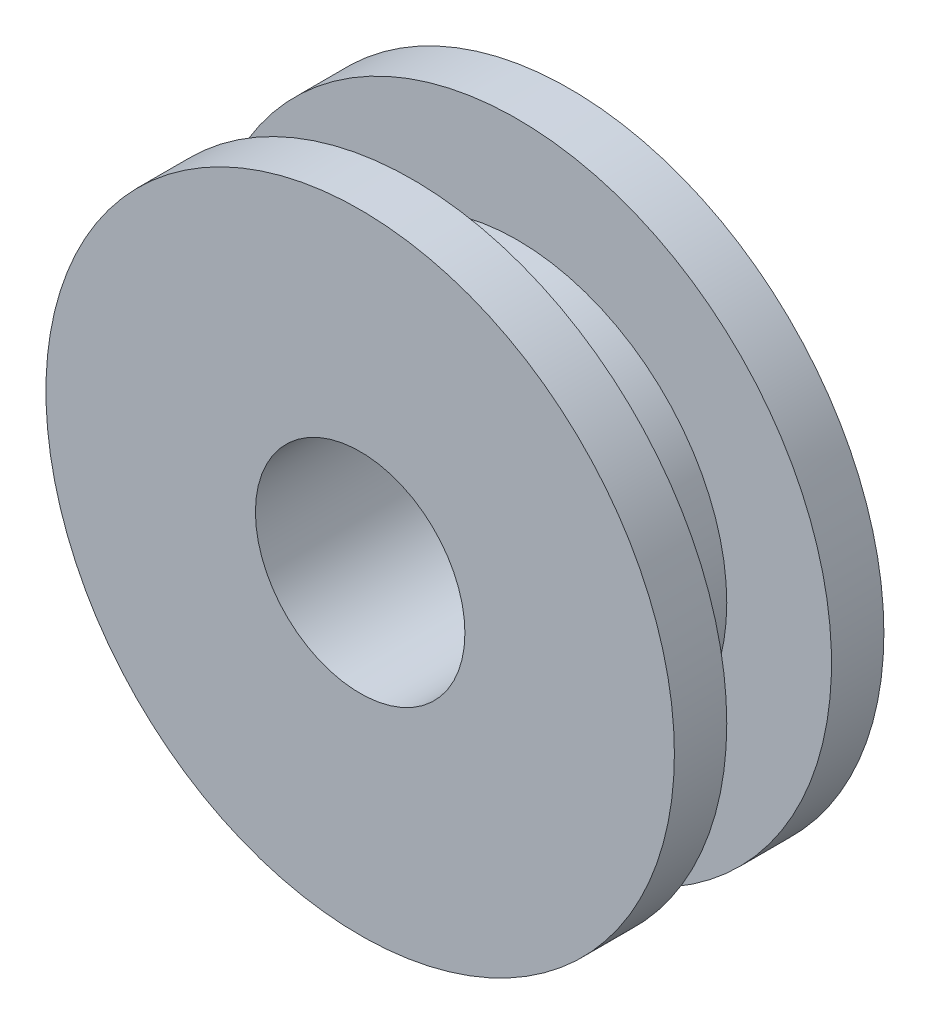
SolidWorks part; units mm, degrees
ref_plane "Ön Düzlem" through (0, 0, 0) normal (0, 0, 1) x (1, 0, 0)
ref_plane "Üst Düzlem" through (0, 0, 0) normal (0, 1, 0) x (1, 0, 0)
ref_plane "Sağ Düzlem" through (0, 0, 0) normal (1, 0, 0) x (0, 0, -1)
sketch "Çizim1" plane through (0, 0, 0) normal (0, 0, 1) x (1, 0, 0)
  circle A0 centre (0, 0) radius 60
  dimension "D1" = 120
extrude "Yükseklik-Ekstrüzyon2" add sketch "Çizim1" along normal blind 40
sketch "Çizim3" plane through (0, 0, 0) normal (1, 0, 0) x (0, 0, -1)
  line L0 (0, 60) -> (-40, 60) construction
  line L1 (-30, 80) -> (-10, 80)
  line L2 (-30, 80) -> (-30, 40)
  line L3 (-30, 40) -> (-10, 40)
  line L4 (-10, 80) -> (-10, 40)
  line L5 (-30, 80) -> (-10, 40) construction
  line L6 (-30, 40) -> (-10, 80) construction
  point P0 (-20, 60)
  dimension "D1" = 20
  dimension "D2" = 40
sweep "Kes-Süpür1" cut profiles "Çizim3"
sketch "Çizim4" plane through (0, 0, 40) normal (0, 0, 1) x (1, 0, 0)
  circle A0 centre (0, 0) radius 20
  dimension "D1" = 40
extrude "Kes-Ekstrüzyon1" cut sketch "Çizim4" against normal blind 40
